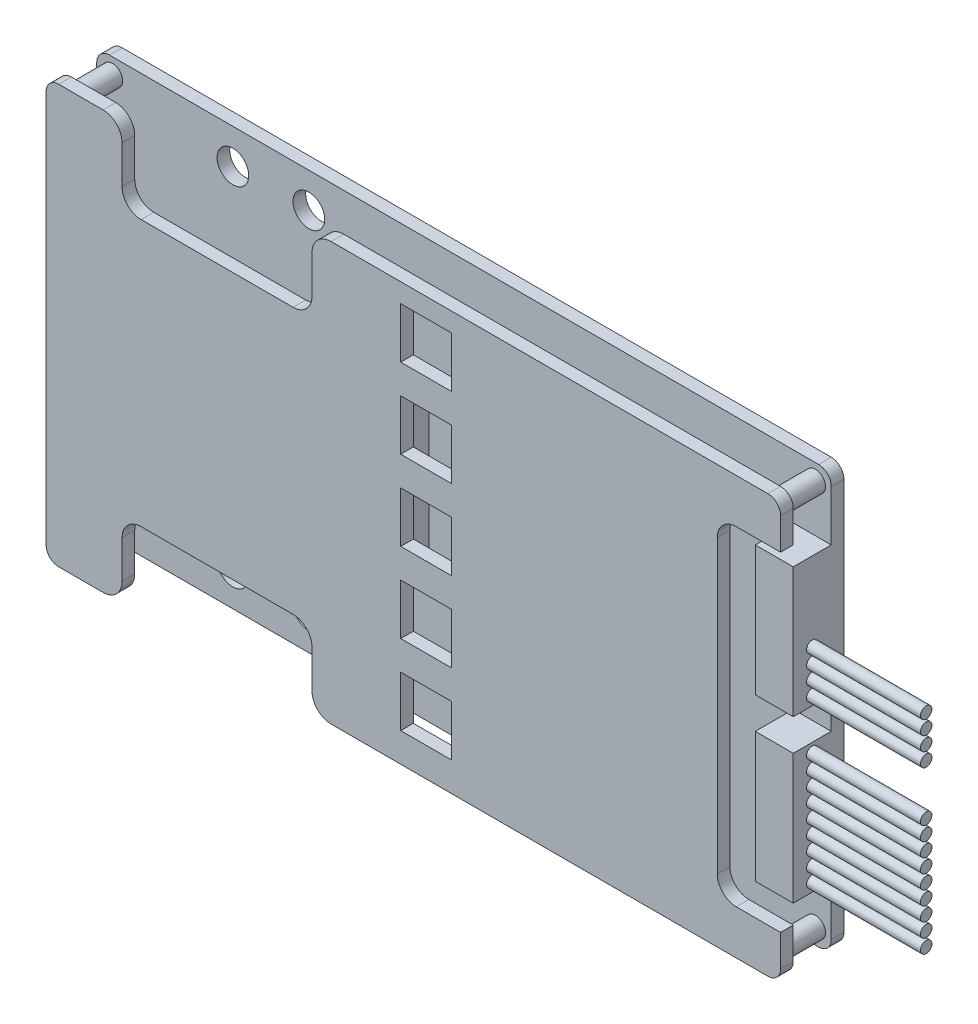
SolidWorks part; units mm, degrees
ref_plane "Plan de face" through (0, 0, 0) normal (0, 0, 1) x (1, 0, 0)
ref_plane "Plan de dessus" through (0, 0, 0) normal (0, 1, 0) x (1, 0, 0)
ref_plane "Plan de droite" through (0, 0, 0) normal (1, 0, 0) x (0, 0, -1)
sketch "Esquisse1" plane through (0, 0, 0) normal (0, 0, 1) x (1, 0, 0)
  line L0 (-58, 33) -> (58, -33) construction
  line L1 (-58, 33) -> (58, 33)
  line L2 (-58, 33) -> (-58, -33)
  line L3 (-58, -33) -> (58, -33)
  line L4 (58, 33) -> (58, -33)
  dimension "D1" = 66
  dimension "D2" = 116
extrude "Boss.-Extru.1" add sketch "Esquisse1" along normal blind 2
fillet "Congé1" radius 2 4 edges at (-58, -33, 1) (58, -33, 1) (58, 33, 1) (-58, 33, 1)
sketch "Esquisse3" plane through (0, 0, 2) normal (0, 0, 1) x (1, 0, 0)
  line L0 (58, -31) -> (58, 31) construction
  line L1 (52, 23) -> (58, 23)
  line L2 (52, 23) -> (52, 2.5)
  line L3 (52, 2.5) -> (58, 2.5)
  line L4 (58, 23) -> (58, 2.5)
  line L5 (-5.5, 0) -> (0, 0) construction
  line L6 (52, -2.5) -> (58, -2.5)
  line L7 (52, -2.5) -> (52, -23)
  line L8 (52, -23) -> (58, -23)
  line L9 (58, -2.5) -> (58, -23)
  line L10 (-55.5, 11.5) -> (-5.5, 11.5)
  line L11 (-55.5, 11.5) -> (-55.5, -11.5)
  line L12 (-55.5, -11.5) -> (-5.5, -11.5)
  line L13 (-5.5, 11.5) -> (-5.5, -11.5)
  line L14 (-55.5, 30.5) -> (-55.5, -30.5) construction
  line L15 (-55.5, -30.5) -> (55.5, -30.5) construction
  line L16 (55.5, -30.5) -> (55.5, 30.5) construction
  line L17 (55.5, 30.5) -> (-55.5, 30.5) construction
  line L18 (56, 33) -> (-56, 33) construction
  line L19 (-58, 31) -> (-58, -31) construction
  line L20 (-56, -33) -> (56, -33) construction
  line L21 (58, 2.5) -> (58, -2.5) construction
  line L22 (58, 0) -> (55.5, 0) construction
  circle A0 centre (-55.5, 30.5) radius 1.6
  circle A1 centre (55.5, 30.5) radius 1.6
  circle A2 centre (55.5, -30.5) radius 1.6
  circle A3 centre (-55.5, -30.5) radius 1.6
  point P33 (0, 0)
  point P34 (-55.5, 10.6656)
  dimension "D1" = 3.2
  dimension "D2" = 2.5
  dimension "D3" = 2.5
  dimension "D4" = 2.5
  dimension "D5" = 2.5
  dimension "D6" = 5
  dimension "D7" = 10
  dimension "D8" = 6
  dimension "D9" = 50
  dimension "D10" = 23
extrude "Boss.-Extru.2" add sketch "Esquisse3" along normal blind 6
sketch "Esquisse4" plane through (0, 0, 8) normal (0, 0, 1) x (1, 0, 0)
  line L0 (-2, 22) -> (-2, 17.4) construction
  line L1 (58, 26) -> (48, 26)
  line L3 (58, -26) -> (48, -26)
  line L4 (-56, -33) -> (56, -33)
  line L5 (-58, 31) -> (-58, -31)
  line L6 (56, 33) -> (-56, 33)
  line L7 (58, -31) -> (58, 31)
  line L8 (-56, -33) -> (-46, -33)
  line L9 (-58, 31) -> (-58, -31)
  line L10 (56, 33) -> (-16, 33)
  line L11 (58, -31) -> (58, -26)
  line L12 (48, 26) -> (48, -26)
  line L14 (-46, 33) -> (-46, 21)
  line L15 (-46, 21) -> (-16, 21)
  line L16 (-16, 33) -> (-16, 21)
  line L18 (-46, -33) -> (-46, -21)
  line L19 (-46, -21) -> (-16, -21)
  line L20 (-16, -33) -> (-16, -21)
  line L21 (-2, 30) -> (6, 30)
  line L22 (-2, 30) -> (-2, 22)
  line L23 (-2, 22) -> (6, 22)
  line L24 (6, 30) -> (6, 22)
  line L25 (-2, 17.4) -> (6, 17.4)
  line L26 (-2, 17.4) -> (-2, 9.4)
  line L27 (-2, 9.4) -> (6, 9.4)
  line L28 (6, 17.4) -> (6, 9.4)
  line L29 (-2, 4.8) -> (6, 4.8)
  line L30 (-2, 4.8) -> (-2, -3.2)
  line L31 (-2, -3.2) -> (6, -3.2)
  line L32 (6, 4.8) -> (6, -3.2)
  line L33 (-2, -7.8) -> (6, -7.8)
  line L34 (-2, -7.8) -> (-2, -15.8)
  line L35 (-2, -15.8) -> (6, -15.8)
  line L36 (6, -7.8) -> (6, -15.8)
  line L37 (-2, -20.4) -> (6, -20.4)
  line L38 (-2, -20.4) -> (-2, -28.4)
  line L39 (-2, -28.4) -> (6, -28.4)
  line L40 (6, -20.4) -> (6, -28.4)
  line L41 (-2, 9.4) -> (-2, 4.8) construction
  line L42 (-2, -3.2) -> (-2, -7.8) construction
  line L43 (-2, -15.8) -> (-2, -20.4) construction
  line L44 (-2, -28.4) -> (-2, -33) construction
  line L45 (-46, 33) -> (-56, 33)
  line L46 (-16, -33) -> (56, -33)
  line L47 (58, 26) -> (58, 31)
  arc A4 (-58, -31) -> (-56, -33) centre (-56, -31) ccw
  arc A5 (-56, 33) -> (-58, 31) centre (-56, 31) ccw
  arc A6 (58, 31) -> (56, 33) centre (56, 31) ccw
  arc A7 (56, -33) -> (58, -31) centre (56, -31) ccw
  arc A8 (-58, -31) -> (-56, -33) centre (-56, -31) ccw
  arc A9 (-56, 33) -> (-58, 31) centre (-56, 31) ccw
  arc A10 (58, 31) -> (56, 33) centre (56, 31) ccw
  arc A11 (56, -33) -> (58, -31) centre (56, -31) ccw
  point P44 (0, 0)
  point P46 (5.2323, -15.0323)
  dimension "D2" = 63
  dimension "D3" = 56
  dimension "D4" = 8
  dimension "D5" = 12
  dimension "D6" = 12
  dimension "D7" = 30
  dimension "D8" = 7
  dimension "D9" = 7
  dimension "D10" = 10
  dimension "D1" = 0
extrude "Boss.-Extru.3" add sketch "Esquisse4" along normal offset from surface (2 mm away) 10
fillet "Congé2" radius 3 10 edges at (48, -26, 9) (48, 26, 9) (-46, -33, 9) (-46, -21, 9) (-16, -33, 9) (-16, -21, 9) (-16, 21, 9) (-16, 33, 9) (-46, 33, 9) (-46, 21, 9)
sketch "Esquisse5" plane through (0, 0, 2) normal (0, 0, 1) x (1, 0, 0)
  line L0 (-36.5, 27.5) -> (-24.5, 27.5) construction
  line L1 (-36.5, 27.5) -> (-36.5, -27.5) construction
  line L2 (-36.5, -27.5) -> (-24.5, -27.5) construction
  line L3 (-58, 31) -> (-58, -31) construction
  line L4 (56, 33) -> (-56, 33) construction
  line L5 (-58, 0) -> (-36.5, 0) construction
  circle A0 centre (-36.5, 27.5) radius 2.5
  circle A1 centre (-24.5, 27.5) radius 2.5
  circle A2 centre (-36.5, -27.5) radius 2.5
  circle A3 centre (-24.5, -27.5) radius 2.5
  dimension "D2" = 5
  dimension "D1" = 12
  dimension "D3" = 21.5
  dimension "D4" = 5.5
extrude "Enlèv. mat.-Extru.1" cut sketch "Esquisse5" against normal through all
sketch "Esquisse6" plane through (58, 0, 0) normal (1, 0, 0) x (0, 0, -1)
  line L0 (-5, 23) -> (-5, -23) construction
  line L1 (-8, 23) -> (-2, 23) construction
  line L2 (-8, -23) -> (-2, -23) construction
  line L3 (-8, 2.5) -> (-2, 2.5) construction
  circle A0 centre (-5, -21.5) radius 0.9
  circle A1 centre (-5, 4) radius 0.9
  dimension "D1" = 1.8
  dimension "D2" = 1.5
  dimension "D3" = 1.5
extrude "Boss.-Extru.4" add sketch "Esquisse6" along normal blind 18
pattern_linear "Répétition linéaire3" count 9 spacing 2.2 along (0, 1, 0) of "Boss.-Extru.4"
sketch "Esquisse7" plane through (58, 0, 0) normal (1, 0, 0) x (0, 0, -1)
  line L0 (0, -31) -> (0, 31) construction
  line L1 (-8, 23) -> (0, 23)
  line L2 (-8, 23) -> (-8, 11.9)
  line L3 (-8, 11.9) -> (0, 11.9)
  line L4 (0, 23) -> (0, 11.9)
  circle A0 centre (-5, 12.8) radius 0.9 construction
  point P5 (0, 11.8417)
extrude "Enlèv. mat.-Extru.2" cut sketch "Esquisse7" along normal through all
